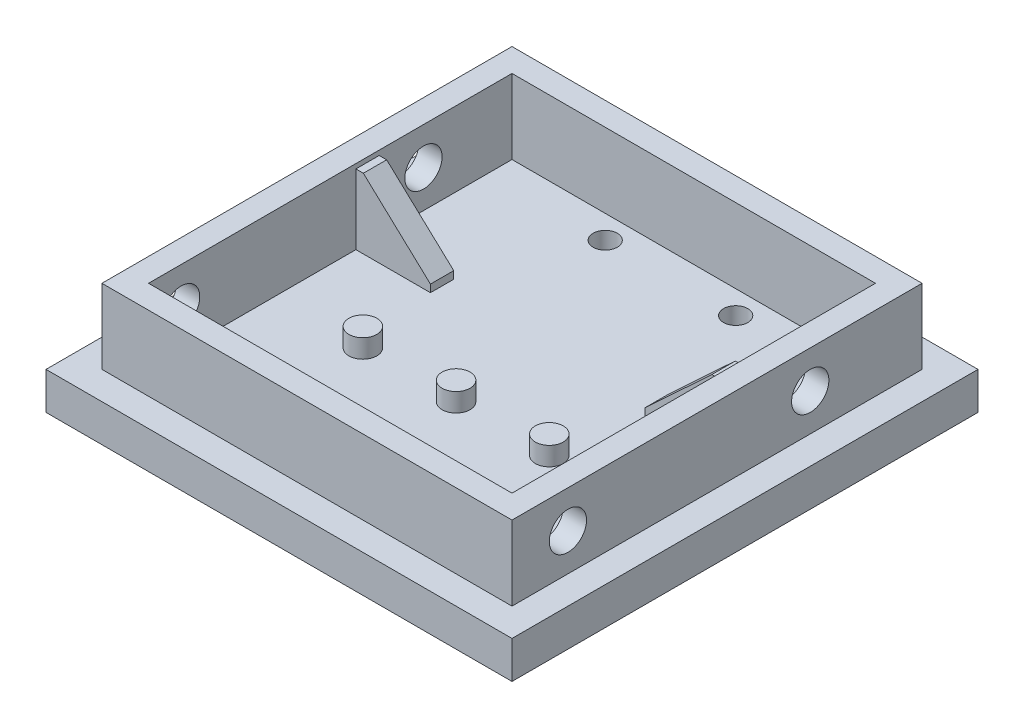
SolidWorks part; units mm, degrees
ref_plane "前视基准面" through (0, 0, 0) normal (0, 0, 1) x (1, 0, 0)
ref_plane "上视基准面" through (0, 0, 0) normal (0, 1, 0) x (1, 0, 0)
ref_plane "右视基准面" through (0, 0, 0) normal (1, 0, 0) x (0, 0, -1)
sketch "草图1" plane through (0, 0, 0) normal (0, 1, 0) x (1, 0, 0)
  line L1 (-25, -25) -> (25, -25)
  line L2 (-25, -25) -> (-25, 25)
  line L3 (-25, 25) -> (25, 25)
  line L4 (25, -25) -> (25, 25)
  line L5 (-25, -25) -> (25, 25) construction
  line L6 (-25, 25) -> (25, -25) construction
  point P0 (0, 0)
  dimension "D1" = 50
  dimension "D2" = 50
extrude "凸台-拉伸1" add sketch "草图1" along normal blind 4
sketch "草图3" plane through (0, 4, 0) normal (0, 1, 0) x (1, 0, 0)
  line L0 (-7, 17) -> (7, 17) construction
  line L1 (0, 25) -> (0, 17) construction
  line L2 (25, 25) -> (-25, 25) construction
  circle A0 centre (-7, 17) radius 1.3
  circle A1 centre (7, 17) radius 1.3
  dimension "D3" = 2.6
  dimension "D1" = 8
  dimension "D2" = 14
extrude "切除-拉伸1" cut sketch "草图3" against normal up to surface (4 mm away)
sketch "草图4" plane through (0, 4, 0) normal (0, 1, 0) x (1, 0, 0)
  line L0 (25, 25) -> (-25, 25) construction
  line L1 (-19.5, -19.5) -> (19.5, -19.5)
  line L2 (-19.5, -19.5) -> (-19.5, 19.5)
  line L3 (-19.5, 19.5) -> (19.5, 19.5)
  line L4 (19.5, -19.5) -> (19.5, 19.5)
  line L5 (-19.5, -19.5) -> (19.5, 19.5) construction
  line L6 (-19.5, 19.5) -> (19.5, -19.5) construction
  line L7 (-22, -22) -> (22, -22)
  line L8 (-22, -22) -> (-22, 22)
  line L9 (-22, 22) -> (22, 22)
  line L10 (22, -22) -> (22, 22)
  line L11 (-22, -22) -> (22, 22) construction
  line L12 (-22, 22) -> (22, -22) construction
  line L13 (25, -25) -> (25, 25) construction
  point P0 (0, 0)
  point P6 (0, 0)
  dimension "D1" = 3
  dimension "D2" = 3
  dimension "D3" = 2.5
  dimension "D4" = 2.5
extrude "凸台-拉伸2" add sketch "草图4" along normal blind 8 contours L10 L9 L8 L7 | L3 L4 L1 L2
sketch "草图6" plane through (0, 4, 0) normal (0, 1, 0) x (1, 0, 0)
  line L0 (0, 0) -> (0, -6) construction
  line L1 (-10, -6) -> (10, -6) construction
  circle A0 centre (0, -6) radius 1.5
  circle A1 centre (10, -6) radius 1.5
  circle A2 centre (-10, -6) radius 1.5
  dimension "D1" = 3
  dimension "D2" = 6
  dimension "D3" = 3
  dimension "D4" = 20
extrude "凸台-拉伸3" add sketch "草图6" along normal blind 2
sketch "草图7" plane through (-22, 0, 0) normal (-1, 0, 0) x (0, 0, 1)
  line L0 (-10, 8) -> (16, 8) construction
  line L2 (-25, 4) -> (25, 4) construction
  line L3 (-22, 12) -> (-22, 4) construction
  line L4 (22, 12) -> (22, 4) construction
  circle A0 centre (16, 8) radius 2
  circle A1 centre (-10, 8) radius 2
  dimension "D2" = 4
  dimension "D4" = 6
  dimension "D1" = 4
  dimension "D3" = 12
extrude "切除-拉伸2" cut sketch "草图7" against normal through all
sketch "草图8" plane through (0, 0, 0) normal (0, 0, 1) x (1, 0, 0)
  line L0 (-19.5, 11.5) -> (-18.7, 11.5)
  line L5 (0, 0) -> (0, 17.9052) construction
  line L6 (-19.5, 12) -> (-19.5, 4) construction
  line L7 (-18.7, 11.5) -> (-11.5, 4.8)
  line L8 (-11.5, 4.8) -> (-11.5, 4)
  line L9 (-25, 4) -> (25, 4) construction
  line L10 (-11.5, 4) -> (-19.5, 4)
  line L11 (-19.5, 4) -> (-19.5, 11.5)
  line L12 (19.5, 4) -> (19.5, 11.5)
  line L13 (11.5, 4) -> (19.5, 4)
  line L14 (11.5, 4.8) -> (11.5, 4)
  line L15 (18.7, 11.5) -> (11.5, 4.8)
  line L16 (19.5, 11.5) -> (18.7, 11.5)
  dimension "D1" = 7.5
  dimension "D2" = 8
  dimension "D3" = 0.8
  dimension "D4" = 0.8
extrude "凸台-拉伸4" add sketch "草图8" along normal mid plane 2.5 from offset 4
